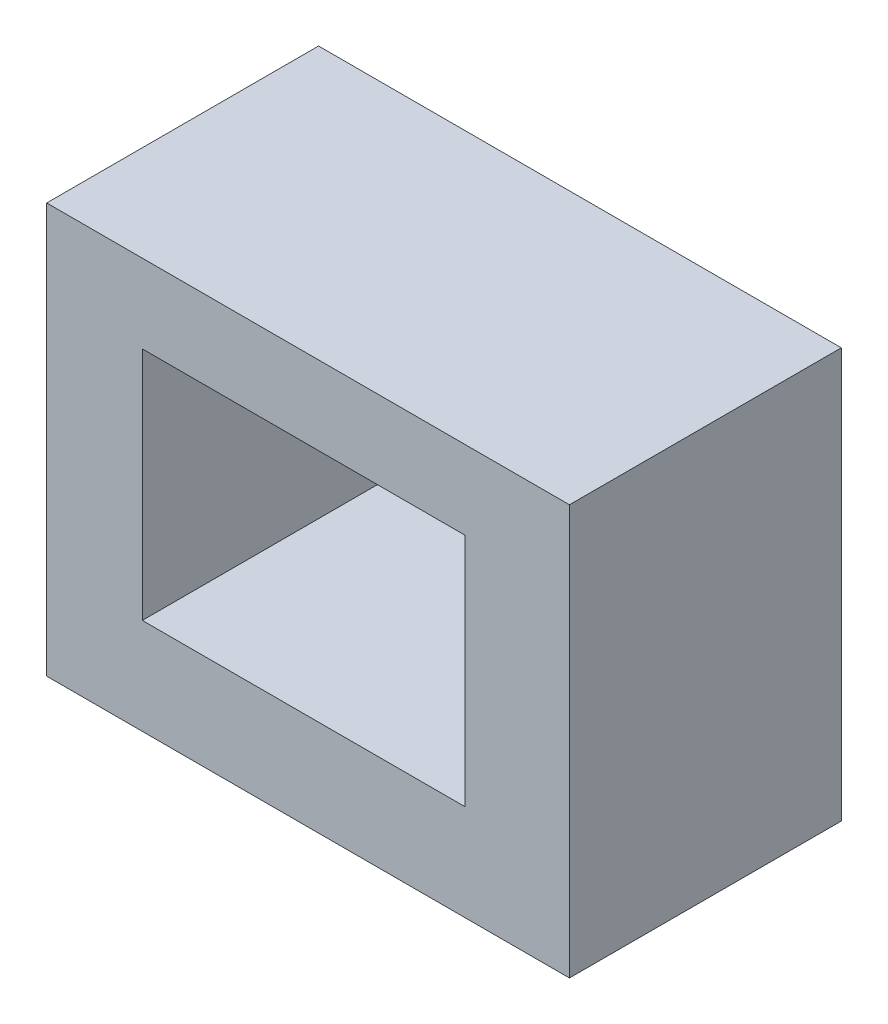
SolidWorks part; units mm, degrees
ref_plane "Front Plane" through (0, 0, 0) normal (0, 0, 1) x (1, 0, 0)
ref_plane "Top Plane" through (0, 0, 0) normal (0, 1, 0) x (1, 0, 0)
ref_plane "Right Plane" through (0, 0, 0) normal (1, 0, 0) x (0, 0, -1)
sketch "Sketch1" plane through (0, 0, 0) normal (0, 0, 1) x (1, 0, 0)
  line L1 (-40.3022, 32.3008) -> (57.3843, 32.3008)
  line L2 (-40.3022, 32.3008) -> (-40.3022, -44.2827)
  line L3 (-40.3022, -44.2827) -> (57.3843, -44.2827)
  line L4 (57.3843, 32.3008) -> (57.3843, -44.2827)
extrude "Extrude1" add sketch "Sketch1" along normal blind 50.8
sketch "Sketch2" plane through (0, 0, 50.8) normal (0, 0, 1) x (1, 0, 0)
  line L1 (-22.4366, 17.6176) -> (37.8811, 17.6176)
  line L2 (-22.4366, 17.6176) -> (-22.4366, -26.3243)
  line L3 (-22.4366, -26.3243) -> (37.8811, -26.3243)
  line L4 (37.8811, 17.6176) -> (37.8811, -26.3243)
extrude "Cut-Extrude1" cut sketch "Sketch2" against normal through all
